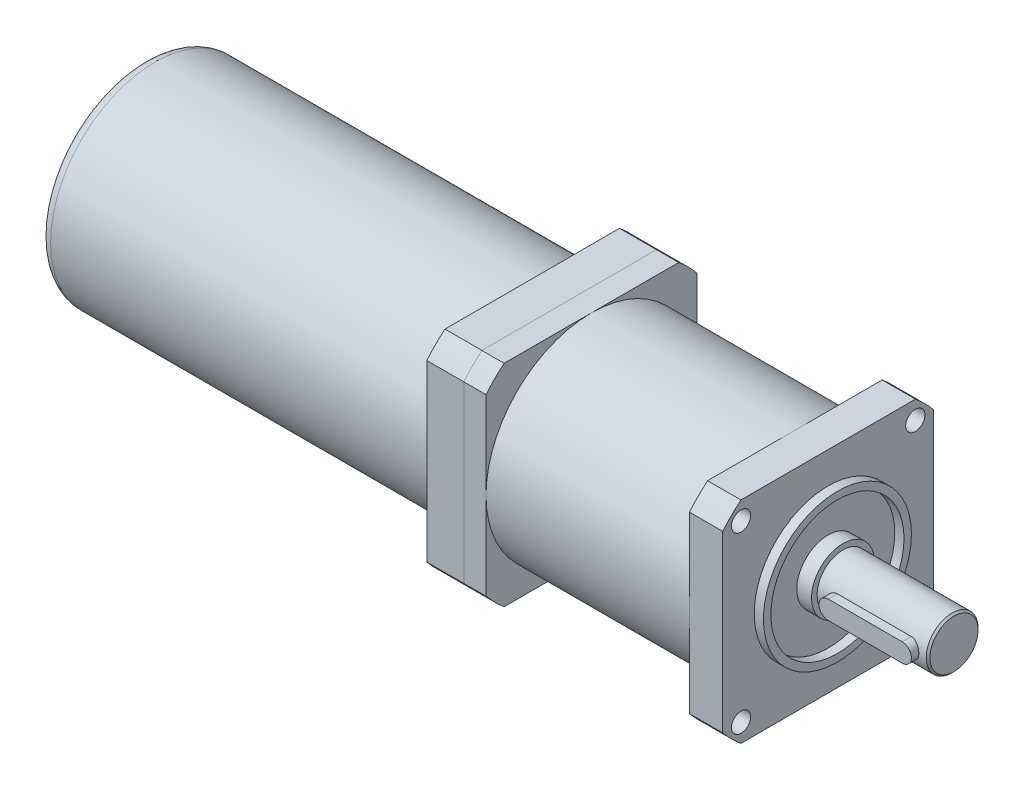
SolidWorks part; units mm, degrees
ref_plane "前视基准面" through (0, 0, 0) normal (0, 0, 1) x (1, 0, 0)
ref_plane "上视基准面" through (0, 0, 0) normal (0, 1, 0) x (1, 0, 0)
ref_plane "右视基准面" through (0, 0, 0) normal (1, 0, 0) x (0, 0, -1)
sketch "草图1" plane through (0, 0, 0) normal (1, 0, 0) x (0, 0, -1)
  line L1 (-23.5956, -28.5) -> (23.5956, -28.5)
  line L2 (-28.5, -23.5956) -> (-28.5, 23.5956)
  line L3 (-23.5956, 28.5) -> (23.5956, 28.5)
  line L4 (28.5, -23.5956) -> (28.5, 23.5956)
  line L5 (-26.163, -26.163) -> (26.163, 26.163) construction
  line L6 (-26.163, 26.163) -> (26.163, -26.163) construction
  arc A0 (-28.5, -23.5956) -> (-23.5956, -28.5) centre (0, 0) ccw
  arc A1 (-23.5956, 28.5) -> (-28.5, 23.5956) centre (0, 0) ccw
  arc A2 (28.5, 23.5956) -> (23.5956, 28.5) centre (0, 0) ccw
  arc A3 (23.5956, -28.5) -> (28.5, -23.5956) centre (0, 0) ccw
  point P0 (0, 0)
extrude "凸台-拉伸1" add sketch "草图1" against normal blind 9
sketch "草图2" plane through (-9, 0, 0) normal (-1, 0, 0) x (0, 0, 1)
  circle A0 centre (0, 0) radius 28.5
extrude "凸台-拉伸2" add sketch "草图2" along normal blind 55
sketch "草图3" plane through (-64, 0, 0) normal (-1, 0, 0) x (0, 0, 1)
  line L1 (-23.5956, -28.5) -> (23.5956, -28.5)
  line L2 (-28.5, -23.5956) -> (-28.5, 23.5956)
  line L3 (-23.5956, 28.5) -> (23.5956, 28.5)
  line L4 (28.5, -23.5956) -> (28.5, 23.5956)
  line L5 (-26.163, -26.163) -> (26.163, 26.163) construction
  line L6 (-26.163, 26.163) -> (26.163, -26.163) construction
  arc A0 (-28.5, -23.5956) -> (-23.5956, -28.5) centre (0, 0) ccw
  arc A1 (23.5956, -28.5) -> (28.5, -23.5956) centre (0, 0) ccw
  arc A2 (28.5, 23.5956) -> (23.5956, 28.5) centre (0, 0) ccw
  arc A3 (-23.5956, 28.5) -> (-28.5, 23.5956) centre (0, 0) ccw
  point P0 (0, 0)
extrude "凸台-拉伸3" add sketch "草图3" along normal blind 6
sketch "草图6" plane through (0, 0, 0) normal (1, 0, 0) x (0, 0, -1)
  circle A0 centre (-23.55, 23.55) radius 2.6
  circle A1 centre (23.55, 23.55) radius 2.6
  circle A2 centre (23.55, -23.55) radius 2.6
  circle A3 centre (-23.55, -23.55) radius 2.6
  point P0 (0, 0)
extrude "切除-拉伸2" cut sketch "草图6" against normal blind 9
sketch "草图7" plane through (0, 0, 0) normal (1, 0, 0) x (0, 0, -1)
  circle A0 centre (0, 0) radius 20
  circle A1 centre (0, 0) radius 18
extrude "凸台-拉伸5" add sketch "草图7" along normal blind 2.5
sketch "草图8" plane through (0, 0, 0) normal (1, 0, 0) x (0, 0, -1)
  circle A0 centre (0, 0) radius 8.5
extrude "凸台-拉伸6" add sketch "草图8" along normal blind 4
sketch "草图9" plane through (4, 0, 0) normal (1, 0, 0) x (0, 0, -1)
  circle A0 centre (0, 0) radius 7
extrude "凸台-拉伸7" add sketch "草图9" along normal blind 30
ref_plane "基准面1" through (0, 0, 7) normal (0, 0, 1) x (1, 0, 0)
sketch "草图10" plane through (0, 0, 7) normal (0, 0, 1) x (1, 0, 0)
  line L3 (9, 2.5) -> (29, 2.5)
  line L5 (29, -2.5) -> (9, -2.5)
  arc A0 (29, -2.5) -> (29, 2.5) centre (29, 0) ccw
  arc A1 (9, 2.5) -> (9, -2.5) centre (9, 0) ccw
extrude "切除-拉伸3" cut sketch "草图10" against normal blind 3
sketch "草图11" plane through (0, 0, 4) normal (0, 0, 1) x (1, 0, 0)
  line L0 (9, 2.5) -> (29, 2.5)
  line L2 (29, -2.5) -> (9, -2.5)
  arc A0 (9, 2.5) -> (9, -2.5) centre (9, 0) ccw
  arc A1 (29, -2.5) -> (29, 2.5) centre (29, 0) ccw
extrude "凸台-拉伸8" add sketch "草图11" along normal blind 5
chamfer "倒角1" distance 0.5 angle 45 1 edges at (34, 0, -7)
sketch "草图14" plane through (-70, 0, 0) normal (-1, 0, 0) x (0, 0, 1)
  line L1 (-23.5956, -28.5) -> (23.5956, -28.5)
  line L2 (-28.5, -23.5956) -> (-28.5, 23.5956)
  line L3 (-23.5956, 28.5) -> (23.5956, 28.5)
  line L4 (28.5, -23.5956) -> (28.5, 23.5956)
  line L5 (-26.163, -26.163) -> (26.163, 26.163) construction
  line L6 (-26.163, 26.163) -> (26.163, -26.163) construction
  arc A0 (-23.5956, 28.5) -> (-28.5, 23.5956) centre (0, 0) ccw
  arc A1 (-28.5, -23.5956) -> (-23.5956, -28.5) centre (0, 0) ccw
  arc A2 (23.5956, -28.5) -> (28.5, -23.5956) centre (0, 0) ccw
  arc A3 (28.5, 23.5956) -> (23.5956, 28.5) centre (0, 0) ccw
  point P0 (0, 0)
extrude "凸台-拉伸9" add sketch "草图14" along normal blind 10 separate body
sketch "草图15" plane through (-80, 0, 0) normal (-1, 0, 0) x (0, 0, 1)
  circle A0 centre (0, 0) radius 28.2
extrude "凸台-拉伸10" add sketch "草图15" along normal blind 105
fillet "圆角1" radius 3 1 edges at (-185, 0, 28.2)
